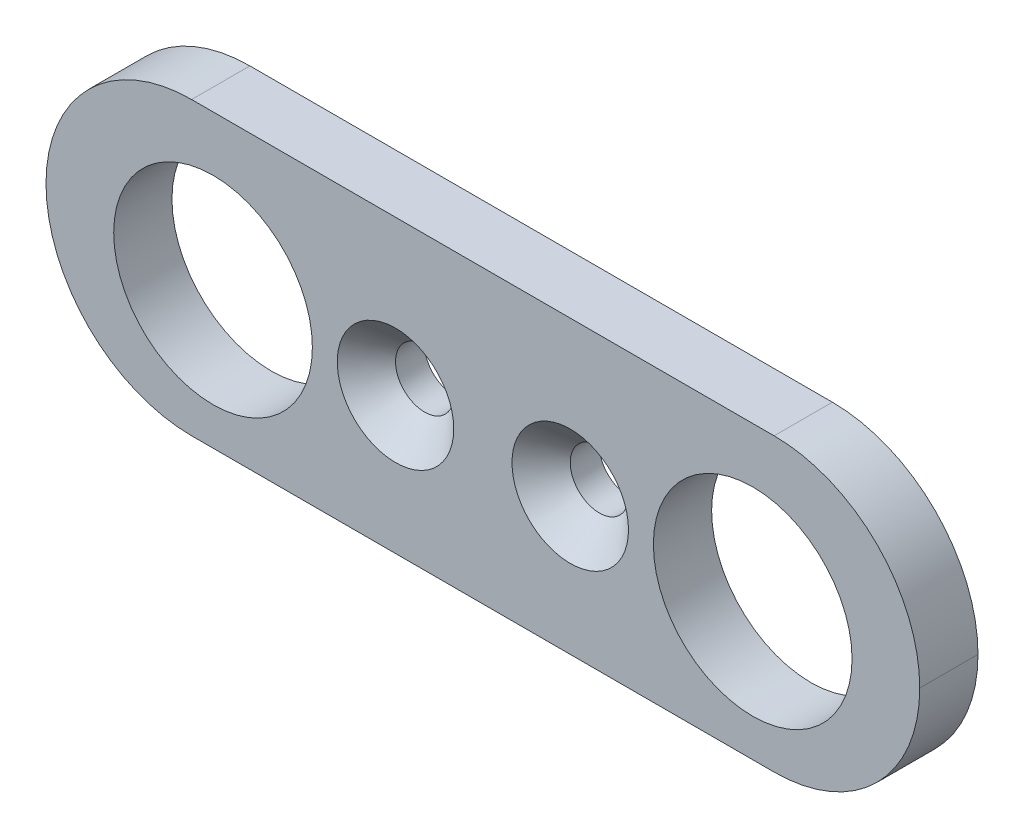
SolidWorks part; units mm, degrees
ref_plane "Plan de face" through (0, 0, 0) normal (0, 0, 1) x (1, 0, 0)
ref_plane "Plan de dessus" through (0, 0, 0) normal (0, 1, 0) x (1, 0, 0)
ref_plane "Plan de droite" through (0, 0, 0) normal (1, 0, 0) x (0, 0, -1)
sketch "Esquisse1" plane through (0, 0, 0) normal (0, 0, 1) x (1, 0, 0)
  line L4 (15, 96.0584) -> (-45, 96.0584)
  line L5 (15, 76.0584) -> (15, 96.0584)
  line L6 (-45, 76.0584) -> (15, 76.0584)
  line L7 (-45, 96.0584) -> (-45, 76.0584)
  line L8 (15, 96.0584) -> (-45, 96.0584)
  line L9 (15, 76.0584) -> (15, 96.0584)
  line L10 (-45, 76.0584) -> (15, 76.0584)
  line L11 (-45, 96.0584) -> (-45, 76.0584)
  dimension "D1" = 0
extrude "Boss.-Extru.1" add sketch "Esquisse1" along normal blind 4
sketch "Esquisse2" plane through (0, 0, 4) normal (0, 0, 1) x (1, 0, 0)
  line L0 (-15, 96.0584) -> (-15, 69.5886) construction
  line L1 (-15, 96.0584) -> (-15, 69.5886) construction
  circle A0 centre (-21, 85.4673) radius 2
  circle A1 centre (-9, 85.4673) radius 2
  circle A2 centre (-33.5298, 85.4673) radius 6.8218
  circle A3 centre (3.5298, 85.4673) radius 6.8218
  dimension "D1" = 4
  dimension "D2" = 12
extrude "Enlèv. mat.-Extru.1" cut sketch "Esquisse2" against normal through all
chamfer "Chanfrein1" distance 2 angle 45 2 edges at (-11, 85.4673, 4) (-19, 85.4673, 4)
fillet "Congé1" radius 10 4 edges at (15, 96.0584, 2) (-45, 96.0584, 2) (-45, 76.0584, 2) (15, 76.0584, 2)
